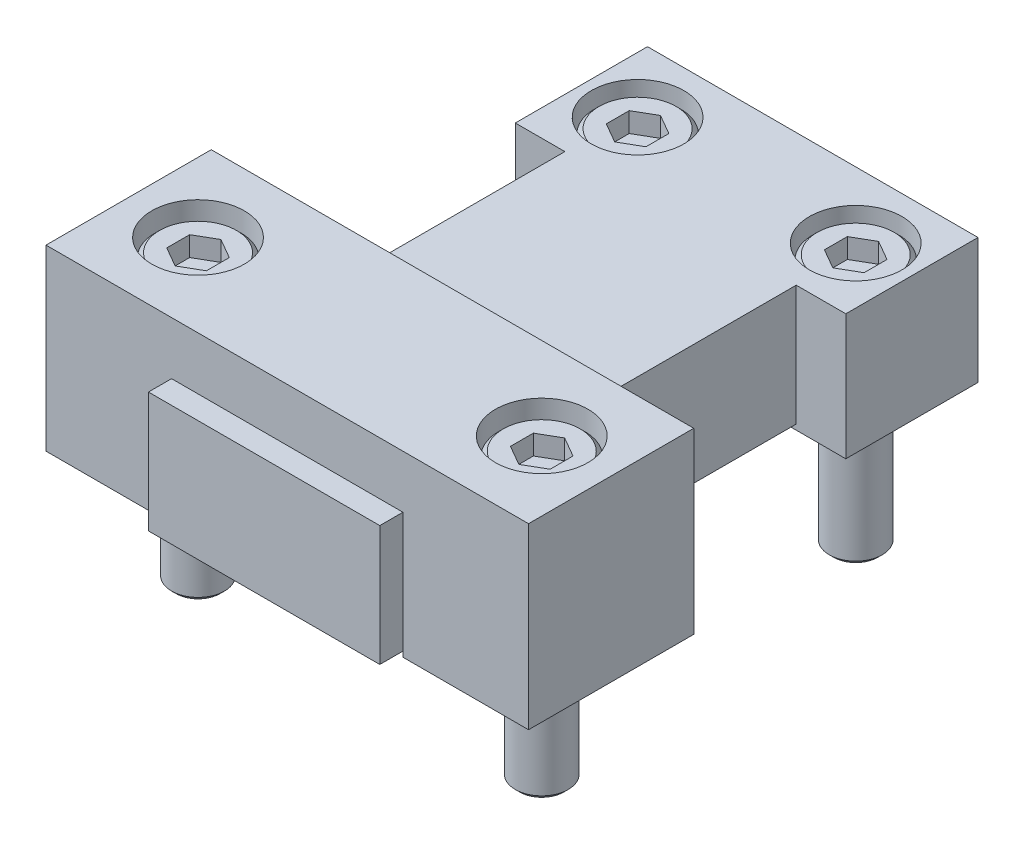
SolidWorks part; units mm, degrees
ref_plane "Front Plane" through (0, 0, 0) normal (0, 0, 1) x (1, 0, 0)
ref_plane "Top Plane" through (0, 0, 0) normal (0, 1, 0) x (1, 0, 0)
ref_plane "Right Plane" through (0, 0, 0) normal (1, 0, 0) x (0, 0, -1)
sketch "Sketch1" plane through (0, 0, 0) normal (0, 1, 0) x (1, 0, 0)
  line L1 (-36.5, 12.5) -> (36.5, 12.5)
  line L2 (-36.5, 12.5) -> (-36.5, -12.5)
  line L3 (-36.5, -12.5) -> (36.5, -12.5)
  line L4 (36.5, 12.5) -> (36.5, -12.5)
  point P4 (0, 12.5)
  point P6 (-36.5, 0)
  dimension "D1" = 25
  dimension "D2" = 73
extrude "Top BLock" add sketch "Sketch1" against normal blind 27
sketch "Sketch2" plane through (0, 0, 12.5) normal (0, 0, 1) x (1, 0, 0)
  line L0 (-36.5, -27) -> (36.5, -27) construction
  line L1 (-17.5, -27) -> (17.5, -27)
  line L2 (-17.5, -27) -> (-17.5, -8)
  line L3 (-17.5, -8) -> (17.5, -8)
  line L4 (17.5, -27) -> (17.5, -8)
  point P4 (0, -8)
  dimension "D1" = 35
  dimension "D2" = 19
extrude "Tob Block Channel" cut sketch "Sketch2" against normal through all
sketch "Sketch4" plane through (0, -8, 0) normal (0, -1, 0) x (1, 0, 0)
  line L0 (17.5, -47) -> (25, -47)
  line L1 (-25, -67) -> (25, -67)
  line L2 (-25, -67) -> (-25, -47)
  line L3 (-25, -47) -> (-17.5, -47)
  line L4 (25, -67) -> (25, -47)
  line L5 (-17.5, 16) -> (17.5, 16)
  line L6 (-17.5, 16) -> (-17.5, -47)
  line L7 (-36.5, 12.5) -> (36.5, 12.5) construction
  line L8 (17.5, 16) -> (17.5, -47)
  line L9 (17.5, -12.5) -> (17.5, 12.5) construction
  line L10 (36.5, -12.5) -> (-36.5, -12.5) construction
  point P5 (0, -67)
  point P6 (0, 16)
  dimension "D1" = 50
  dimension "D2" = 20
  dimension "D3" = 3.5
  dimension "D4" = 34.5
extrude "Extrude4" add sketch "Sketch4" along normal blind 18.2 separate body
sketch "Sketch5" plane through (0, -8, 0) normal (0, 1, 0) x (1, 0, 0)
  line L0 (-16.5, 57) -> (16.5, 57) construction
  line L2 (-25, 47) -> (-25, 67) construction
  circle A0 centre (-16.5, 57) radius 7
  circle A1 centre (16.5, 57) radius 7
  point P4 (0, 57)
  point P8 (-25, 57)
  dimension "D2" = 14
  dimension "D1" = 16.5
extrude "Extrude5" cut sketch "Sketch5" against normal blind 9.5
sketch "Sketch16" plane through (0, -26.2, 0) normal (0, -1, 0) x (1, 0, 0)
  line L1 (25, -67) -> (-25, -67)
  line L2 (25, -67) -> (25, -47)
  line L3 (25, -47) -> (-25, -47)
  line L4 (-25, -67) -> (-25, -47)
extrude "Extrude15" add sketch "Sketch16" along normal offset from surface (0.8 mm away) 19
sketch "Sketch6" plane through (0, -17.5, 0) normal (0, 1, 0) x (1, 0, 0)
  circle A0 centre (-16.5, 57) radius 4.5
  circle A1 centre (16.5, 57) radius 4.5
  circle A3 centre (16.5, 57) radius 7 construction
  circle A4 centre (-16.5, 57) radius 7 construction
  dimension "D1" = 9
extrude "Extrude6" cut sketch "Sketch6" against normal through all
sketch "Sketch7" plane through (0, 0, 0) normal (0, 1, 0) x (1, 0, 0)
  line L0 (-26, 0) -> (26, 0) construction
  circle A0 centre (-26, 0) radius 7
  circle A1 centre (26, 0) radius 7
  point P4 (0, 0)
  dimension "D1" = 14
  dimension "D2" = 26
extrude "Extrude7" cut sketch "Sketch7" against normal blind 10
sketch "Sketch8" plane through (0, -10, 0) normal (0, 1, 0) x (1, 0, 0)
  circle A0 centre (-26, 0) radius 4.5
  circle A1 centre (26, 0) radius 4.5
  circle A2 centre (-26, 0) radius 7 construction
  circle A3 centre (26, 0) radius 7 construction
  circle A4 centre (-16.5, 57) radius 4.5 construction
extrude "Extrude8" cut sketch "Sketch8" against normal through all
sketch "Sketch9" plane through (0, -10, 0) normal (0, 1, 0) x (1, 0, 0)
  circle A1 centre (26, 0) radius 6.5
  circle A3 centre (26, 0) radius 7 construction
  dimension "D1" = 13
extrude "Extrude9" add sketch "Sketch9" along normal blind 8 separate body
sketch "Sketch12" plane through (0, -17.5, 0) normal (0, 1, 0) x (1, 0, 0)
  circle A0 centre (16.5, 57) radius 6.5
  circle A1 centre (26, 0) radius 6.5 construction
extrude "Extrude12" add sketch "Sketch12" along normal blind 8 separate body
sketch "Sketch10" plane through (0, -10, 0) normal (0, -1, 0) x (1, 0, 0)
  circle A0 centre (26, 0) radius 4
  circle A1 centre (26, 0) radius 6.5 construction
  dimension "D1" = 8
extrude "Extrude10" add sketch "Sketch10" along normal blind 35
sketch "Sketch11" plane through (0, -2, 0) normal (0, 1, 0) x (1, 0, 0)
  line L1 (29, 1.7321) -> (26, 3.4641)
  line L2 (26, 3.4641) -> (23, 1.7321)
  line L3 (23, 1.7321) -> (23, -1.7321)
  line L4 (23, -1.7321) -> (26, -3.4641)
  line L5 (26, -3.4641) -> (29, -1.7321)
  line L6 (29, -1.7321) -> (29, 1.7321)
  circle A0 centre (26, 0) radius 3 construction
  circle A2 centre (26, 0) radius 6.5 construction
  dimension "D1" = 6
extrude "Extrude11" cut sketch "Sketch11" against normal blind 3
chamfer "Chamfer2" distance 0.667 angle 45 2 edges at (26, -45, -4) (26, -2, 6.5)
sketch "Sketch13" plane through (0, -9.5, 0) normal (0, 1, 0) x (1, 0, 0)
  line L0 (29, -1.7321) -> (29, 1.7321) construction
  line L1 (16.5, 53.5359) -> (19.5, 55.2679)
  line L2 (19.5, 55.2679) -> (19.5, 58.7321)
  line L3 (19.5, 58.7321) -> (16.5, 60.4641)
  line L4 (16.5, 60.4641) -> (13.5, 58.7321)
  line L5 (13.5, 58.7321) -> (13.5, 55.2679)
  line L6 (13.5, 55.2679) -> (16.5, 53.5359)
  circle A0 centre (16.5, 57) radius 3 construction
  circle A1 centre (16.5, 57) radius 6.5 construction
extrude "Extrude13" cut sketch "Sketch13" against normal blind 3
sketch "Sketch14" plane through (0, -17.5, 0) normal (0, -1, 0) x (1, 0, 0)
  circle A0 centre (16.5, -57) radius 4
  circle A1 centre (16.5, -57) radius 4.5 construction
  dimension "D1" = 8
extrude "Extrude14" add sketch "Sketch14" along normal blind 30
chamfer "Chamfer3" distance 0.667 angle 45 2 edges at (16.5, -47.5, -61) (16.5, -9.5, -50.5)
mirror "Mirror1" about plane through (0, 0, 0) normal (1, 0, 0)
mirror "Mirror2" about plane through (0, 0, 0) normal (1, 0, 0)
